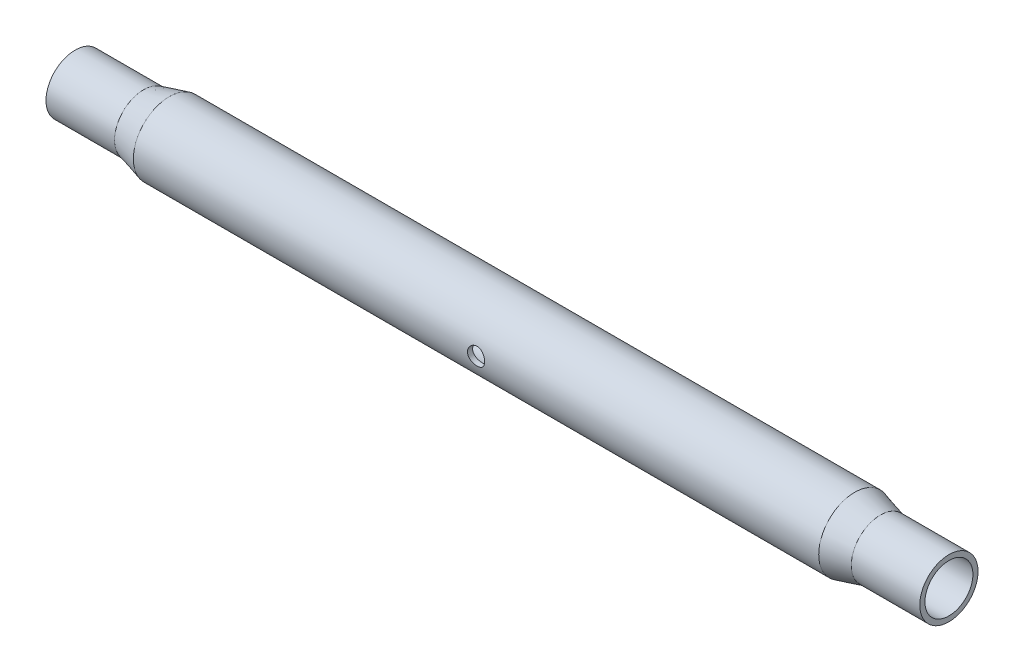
SolidWorks part; units mm, degrees
ref_plane "Plan de face" through (0, 0, 0) normal (0, 0, 1) x (1, 0, 0)
ref_plane "Plan de dessus" through (0, 0, 0) normal (0, 1, 0) x (1, 0, 0)
ref_plane "Plan de droite" through (0, 0, 0) normal (1, 0, 0) x (0, 0, -1)
sketch "Esquisse1" plane through (0, 0, 0) normal (0, 0, 1) x (1, 0, 0)
  line L0 (-91.8957, 0) -> (124.2758, 0) construction
  line L1 (-67.0085, 17) -> (-27.0085, 17)
  line L2 (-27.0085, 17) -> (-12.0085, 21)
  line L3 (-12.0085, 21) -> (387.9915, 21)
  line L4 (387.9915, 21) -> (402.9915, 17)
  line L5 (402.9915, 17) -> (442.9915, 17)
  dimension "D1" = 40
  dimension "D2" = 400
  dimension "D3" = 40
  dimension "D4" = 15
  dimension "D5" = 15
  dimension "D6" = 34
  dimension "D7" = 42
  dimension "D8" = 34
revolve "Révol.-Mince1" add sketch "Esquisse1" angle 360 about L0
sketch "Esquisse2" plane through (0, 0, 0) normal (0, 0, 1) x (1, 0, 0)
  line L0 (-12.0085, 21) -> (-12.0085, -21) construction
  circle A0 centre (187.9915, 0) radius 5
  dimension "D1" = 10
  dimension "D2" = 200
extrude "Enlèv. mat.-Extru.1" cut sketch "Esquisse2" against normal mid plane 60
